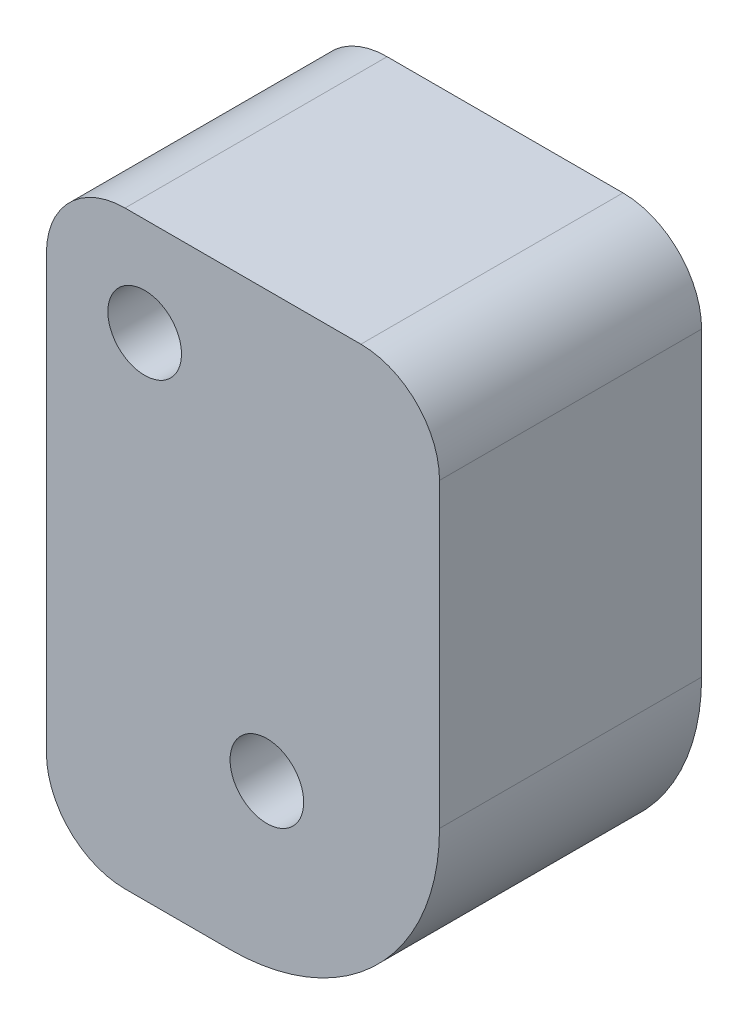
SolidWorks part; units mm, degrees
ref_plane "Front" through (0, 0, 0) normal (0, 0, 1) x (1, 0, 0)
ref_plane "Top" through (0, 0, 0) normal (0, 1, 0) x (1, 0, 0)
ref_plane "Right" through (0, 0, 0) normal (1, 0, 0) x (0, 0, -1)
ref_plane "Plane1"
sketch "Sketch1" plane through (0, 0, 3.2) normal (0, 0, -1) x (-1, 0, 0)
  line L0 (516.3576, -8.8378) -> (529.8547, -8.8378) construction
  line L1 (516.3576, -8.8378) -> (529.8547, -8.8378) construction
  line L3 (513.461, 10.2122) -> (536.321, 10.2122)
  line L4 (505.841, 2.5922) -> (505.841, -26.6178)
  line L5 (543.941, 2.5922) -> (543.941, -39.3178)
  line L6 (526.161, -46.9378) -> (536.321, -46.9378)
  line L8 (538.861, -85.471) -> (538.861, 85.471) construction
  arc A0 (505.841, -26.6178) -> (526.161, -46.9378) centre (526.161, -26.6178) ccw
  arc A2 (536.321, 10.2122) -> (543.941, 2.5922) centre (536.321, 2.5922) cw
  arc A3 (505.841, 2.5922) -> (513.461, 10.2122) centre (513.461, 2.5922) cw
  arc A4 (543.941, -39.3178) -> (536.321, -46.9378) centre (536.321, -39.3178) cw
extrude "Boss-Extrude1" add sketch "Sketch1" against normal blind 25.4 flip side to cut
hole_wizard "Hole1" positions "Point_Sketch" profile "Profil_Sketch" counterbore size "1/4" standard "ANSI Inch"
sketch "Point_Sketch" plane through (-509.7037, -29.7012, 3.2) normal (0, 0, 1) x (-1, 0, 0)
  point P0 (12.8691, 1.3074)
  point P2 (24.7123, -30.3883)
sketch "Profil_Sketch" plane through (-522.5728, -31.0086, 3.2) normal (1, 0, 0) x (0, 1, 0)
  line L0 (0, 0) -> (0, 25.4)
  line L1 (0, 25.4) -> (3.5687, 25.4)
  line L3 (3.5687, 25.4) -> (3.5687, 8.89)
  line L4 (3.5687, 8.89) -> (5.3594, 8.89)
  line L5 (5.3594, 8.89) -> (5.3594, 0)
  line L7 (5.3594, 0) -> (0, 0)
  line L11 (0, -6.35) -> (0, 107.95) construction
  dimension "Diameter" = 7.1374
  dimension "Thru Hole Depth" = 25.4
  dimension "L1" = 8.89
other "usin_LS160_.25-20x.625-SHCS<1>"
surface "Surface-Offset1" [suppressed] parameters "D1"=0
ref_plane "Plane3" [suppressed] through (-523.3142, -9.0072, 3.2422) normal (-1, 0, 0) x (0, 0, 1)
sketch "Sketch2" [suppressed] plane through (-523.3142, -9.0072, 3.2422) normal (-1, 0, 0) x (0, 0, 1)
  line L0 (0, 0) -> (1.3401, -2.5204)
  line L1 (0, 0) -> (0.902, -1.6964)
  line L2 (-0.9555, -56.0406) -> (1.7032, -5.3103)
  line L3 (1.7569, -4.192) -> (1.7569, -9.0468) construction
  line L4 (-0.0422, 0.1693) -> (-0.0422, 25.5693)
  line L5 (-0.0422, 0.2773) -> (-0.0422, 1.6508) construction
  arc A0 (1.7569, -4.192) -> (1.3401, -2.5204) centre (-1.8038, -4.192) ccw
  arc A1 (-0.0422, 0.1693) -> (0, 0) centre (0.3185, 0.1693) ccw
  arc A2 (-0.0422, 0.1693) -> (0, 0) centre (0.3185, 0.1693) ccw
  arc A3 (1.7569, -4.192) -> (1.3401, -2.5204) centre (-1.8038, -4.192) ccw construction
  arc A4 (1.7032, -5.3103) -> (0.902, -1.6964) centre (-5.213, -4.9478) ccw
  point P7 (0.5297, -6.5334)
  dimension "D2" = 0.127
  dimension "D1" = 3
  dimension "D3" = 50.8
  dimension "D4" = 0
  dimension "D5" = 25.4
extrude "Cut-Extrude1" [suppressed] cut sketch "Sketch2" against normal through all both and the other way through all
delete or keep bodies "Body-Delete/Keep 1" [suppressed] type delete bodies bodies 104
